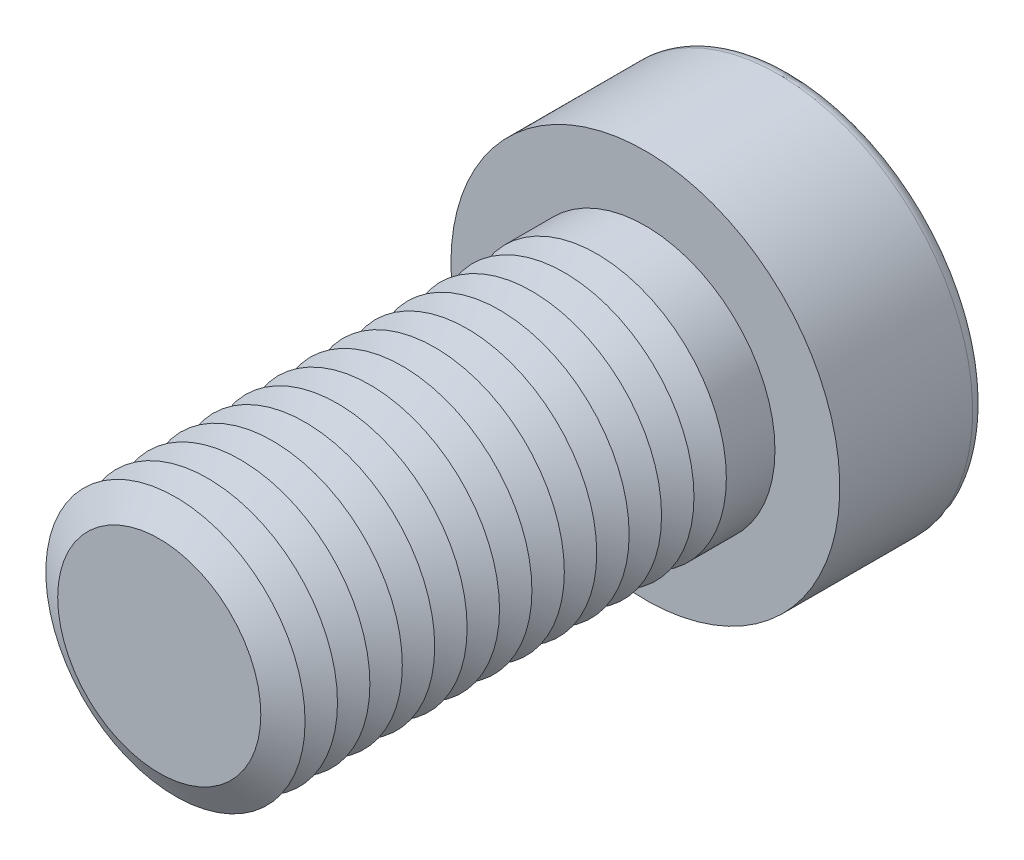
SolidWorks part; units mm, degrees
ref_plane "Front Plane" through (0, 0, 0) normal (0, 0, 1) x (1, 0, 0)
ref_plane "Top Plane" through (0, 0, 0) normal (0, 1, 0) x (1, 0, 0)
ref_plane "Right Plane" through (0, 0, 0) normal (1, 0, 0) x (0, 0, -1)
sketch "Sketch1" plane through (0, 0, 0) normal (0, 0, 1) x (1, 0, 0)
  circle A0 centre (0, 0) radius 8
  dimension "D1" = 16
extrude "Boss-Extrude1" add sketch "Sketch1" along normal blind 30
sketch "Sketch2" plane through (0, 0, 0) normal (0, 0, -1) x (-1, 0, 0)
  circle A0 centre (0, 0) radius 12
  dimension "D1" = 24
extrude "Boss-Extrude2" add sketch "Sketch2" along normal blind 9
sketch "Sketch3" plane through (0, 0, -9) normal (0, 0, -1) x (-1, 0, 0)
  line L1 (-3.4641, 6) -> (-6.9282, 0)
  line L2 (-6.9282, 0) -> (-3.4641, -6)
  line L3 (-3.4641, -6) -> (3.4641, -6)
  line L4 (3.4641, -6) -> (6.9282, 0)
  line L5 (6.9282, 0) -> (3.4641, 6)
  line L6 (3.4641, 6) -> (-3.4641, 6)
  circle A0 centre (0, 0) radius 6 construction
  dimension "D1" = 12
extrude "Cut-Extrude1" cut sketch "Sketch3" against normal blind 9
fillet "Fillet1" radius 0.8 1 edges at (-12, 0, -9)
sketch "Sketch4" plane through (0, 0, 0) normal (0, 0, -1) x (-1, 0, 0)
  line L0 (3.4641, -6) -> (6.9282, 0) construction
  circle A0 centre (0, 0) radius 6
extrude "Cut-Extrude2" cut sketch "Sketch4" against normal through all draft 60
sketch "Sketch5" plane through (0, 0, -9) normal (0, 0, -1) x (-1, 0, 0)
  circle A0 centre (0, 0) radius 6.9282
extrude "Cut-Extrude3" cut sketch "Sketch5" against normal through all draft 75
sketch "Sketch7" plane through (0, 0, 0) normal (1, 0, 0) x (0, 0, -1)
  line L25 (-30, 6.2679) -> (-29, 8)
  line L26 (-30, 8) -> (-30, -8) construction
  line L27 (-29, 8) -> (-31, 8)
  line L28 (-31, 8) -> (-30, 6.2679)
  line L29 (0, 8) -> (-30, 8) construction
  dimension "D1" = 2
revolve "Cut-Revolve1" cut sketch "Sketch7" angle 360 about axis through (0, 0, 30) along (0, 0, -1)
pattern_linear "LPattern1" count 14 spacing 2 along (0, 0, -1) of "Cut-Revolve1"
